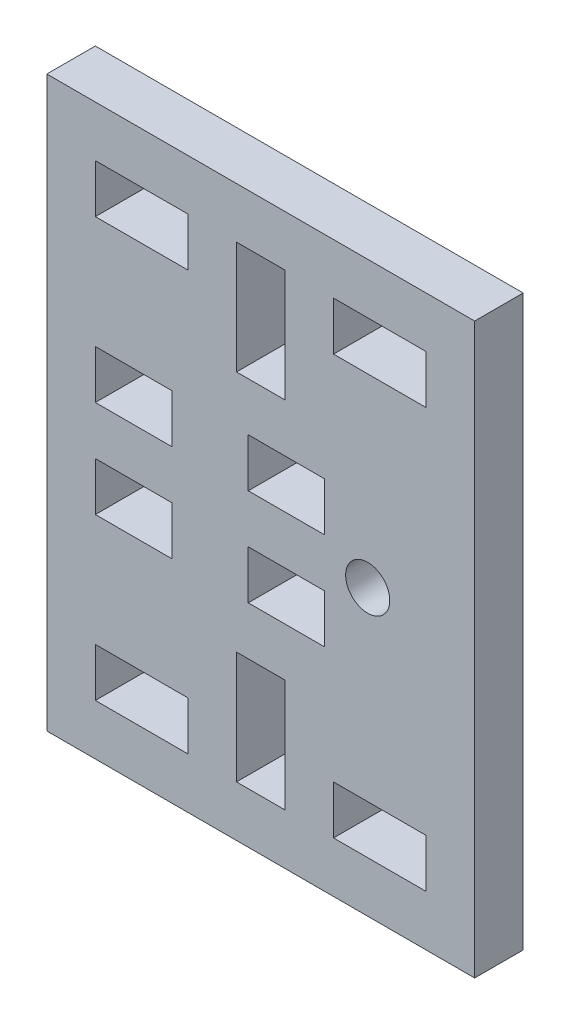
SolidWorks part; units mm, degrees
ref_plane "Front Plane" through (0, 0, 0) normal (0, 0, 1) x (1, 0, 0)
ref_plane "Top Plane" through (0, 0, 0) normal (0, 1, 0) x (1, 0, 0)
ref_plane "Right Plane" through (0, 0, 0) normal (1, 0, 0) x (0, 0, -1)
sketch "Sketch1" plane through (0, 0, 0) normal (0, 0, 1) x (1, 0, 0)
  line L0 (46.3203, -32.6514) -> (3.3203, -32.6514) construction
  line L1 (46.3203, 31.8486) -> (3.3203, 31.8486) construction
  line L2 (3.3203, 31.8486) -> (3.3203, -32.6514) construction
  line L3 (46.3203, 31.8486) -> (46.3203, -32.6514) construction
  line L4 (3.3203, -32.6514) -> (-2.1797, -32.6514) construction
  line L5 (-2.1797, 20.5986) -> (-44.1797, 20.5986) construction
  line L6 (-2.1797, 31.8486) -> (3.3203, 31.8486) construction
  line L7 (3.3203, 20.5986) -> (3.3203, -21.4014) construction
  line L8 (-44.1797, 20.5986) -> (-44.1797, -21.4014) construction
  line L9 (-44.1797, -21.4014) -> (-2.1797, -21.4014) construction
  line L10 (-2.1797, -21.4014) -> (-2.1797, 20.5986) construction
  line L11 (-2.1797, 20.5986) -> (-44.1797, -21.4014) construction
  line L12 (3.3203, 31.8486) -> (3.3203, 26.0986) construction
  line L13 (40.8203, 31.8486) -> (40.8203, -32.6514) construction
  line L14 (3.3203, 26.0986) -> (40.8203, 26.0986) construction
  line L15 (3.3203, -32.6514) -> (3.3203, -26.9014) construction
  line L16 (3.3203, -26.9014) -> (40.8203, -26.9014) construction
  line L17 (3.3203, 26.0986) -> (3.3203, 20.5986) construction
  line L18 (24.8203, -26.9014) -> (19.3203, -26.9014) construction
  line L19 (19.3203, -26.9014) -> (19.3203, -14.1514) construction
  line L20 (19.3203, 26.0986) -> (24.8203, 26.0986) construction
  line L21 (24.8203, 26.0986) -> (24.8203, 13.3486) construction
  line L22 (19.3203, -26.9014) -> (13.8203, -26.9014) construction
  line L23 (13.8203, -26.9014) -> (13.8203, -21.4014) construction
  line L24 (24.8203, 26.0986) -> (30.3203, 26.0986) construction
  line L25 (30.3203, 26.0986) -> (30.3203, 20.5986) construction
  line L26 (3.3203, 20.5986) -> (13.8203, 20.5986) construction
  line L27 (30.3203, 20.5986) -> (40.8203, 20.5986) construction
  line L28 (3.3203, -26.9014) -> (3.3203, -21.4014) construction
  line L29 (3.3203, -3.1514) -> (3.3203, -8.6514) construction
  line L30 (29.3203, -3.1514) -> (3.3203, -3.1514) construction
  line L31 (29.3203, 2.3486) -> (3.3203, 2.3486) construction
  line L32 (3.3203, 2.3486) -> (3.3203, 7.8486) construction
  line L33 (3.3203, 7.8486) -> (29.3203, 7.8486) construction
  line L34 (29.3203, 7.8486) -> (29.3203, 2.3486) construction
  line L35 (3.3203, -8.6514) -> (29.3203, -8.6514) construction
  line L36 (29.3203, -8.6514) -> (29.3203, -3.1514) construction
  line L37 (3.3203, -26.9014) -> (3.3203, -21.4014) construction
  line L38 (3.3203, -26.9014) -> (3.3203, -21.4014) construction
  line L39 (3.3203, -21.4014) -> (13.8203, -21.4014) construction
  line L40 (-44.1797, 20.5986) -> (-2.1797, -21.4014) construction
  line L41 (24.8203, 13.3486) -> (19.3203, 13.3486) construction
  line L42 (24.8203, -26.9014) -> (24.8203, -14.1514) construction
  line L43 (24.8203, -14.1514) -> (19.3203, -14.1514) construction
  line L44 (30.3203, -21.4014) -> (40.8203, -21.4014) construction
  line L45 (30.3203, -21.4014) -> (40.8203, -21.4014)
  line L46 (20.6537, 7.8486) -> (11.987, 7.8486) construction
  line L47 (11.987, 7.8486) -> (11.987, 2.3486) construction
  line L48 (13.8203, 20.5986) -> (13.8203, 26.0986) construction
  line L49 (29.3203, -3.1514) -> (20.6537, -3.1514) construction
  line L50 (20.6537, -3.1514) -> (20.6537, -8.6514) construction
  line L51 (20.6537, -8.6514) -> (11.987, -8.6514) construction
  line L52 (19.3203, 13.3486) -> (19.3203, 26.0986) construction
  line L53 (20.6537, 2.3486) -> (20.6537, 7.8486) construction
  line L54 (11.987, -8.6514) -> (11.987, -3.1514) construction
  line L55 (30.3203, -21.4014) -> (30.3203, -26.9014) construction
  line L56 (-2.1797, 31.8486) -> (46.3203, 31.8486)
  line L57 (46.3203, 31.8486) -> (46.3203, -32.6514)
  line L58 (46.3203, -32.6514) -> (-2.1797, -32.6514)
  line L59 (3.3203, 26.0986) -> (13.8203, 26.0986)
  line L60 (13.8203, 26.0986) -> (13.8203, 20.5986)
  line L61 (13.8203, 20.5986) -> (3.3203, 20.5986)
  line L62 (3.3203, 20.5986) -> (3.3203, 26.0986)
  line L63 (19.3203, 26.0986) -> (19.3203, 13.3486)
  line L64 (19.3203, 13.3486) -> (24.8203, 13.3486)
  line L65 (24.8203, 13.3486) -> (24.8203, 26.0986)
  line L66 (24.8203, 26.0986) -> (19.3203, 26.0986)
  line L67 (30.3203, 26.0986) -> (40.8203, 26.0986)
  line L68 (40.8203, 26.0986) -> (40.8203, 20.5986)
  line L69 (40.8203, 20.5986) -> (30.3203, 20.5986)
  line L70 (30.3203, 20.5986) -> (30.3203, 26.0986)
  line L71 (3.3203, 7.8486) -> (11.987, 7.8486)
  line L72 (11.987, 7.8486) -> (11.987, 2.3486)
  line L73 (11.987, 2.3486) -> (3.3203, 2.3486)
  line L74 (3.3203, 2.3486) -> (3.3203, 7.8486)
  line L75 (20.6537, 7.8486) -> (29.3203, 7.8486)
  line L76 (29.3203, 7.8486) -> (29.3203, 2.3486)
  line L77 (29.3203, 2.3486) -> (20.6537, 2.3486)
  line L78 (20.6537, 2.3486) -> (20.6537, 7.8486)
  line L79 (3.3203, -3.1514) -> (11.987, -3.1514)
  line L80 (11.987, -3.1514) -> (11.987, -8.6514)
  line L81 (11.987, -8.6514) -> (3.3203, -8.6514)
  line L82 (3.3203, -8.6514) -> (3.3203, -3.1514)
  line L83 (20.6537, -3.1514) -> (29.3203, -3.1514)
  line L84 (29.3203, -3.1514) -> (29.3203, -8.6514)
  line L85 (29.3203, -8.6514) -> (20.6537, -8.6514)
  line L86 (20.6537, -8.6514) -> (20.6537, -3.1514)
  line L87 (3.3203, -21.4014) -> (13.8203, -21.4014)
  line L88 (13.8203, -21.4014) -> (13.8203, -26.9014)
  line L89 (13.8203, -26.9014) -> (3.3203, -26.9014)
  line L90 (3.3203, -26.9014) -> (3.3203, -21.4014)
  line L91 (19.3203, -26.9014) -> (19.3203, -14.1514)
  line L92 (19.3203, -14.1514) -> (24.8203, -14.1514)
  line L93 (24.8203, -14.1514) -> (24.8203, -26.9014)
  line L94 (24.8203, -26.9014) -> (19.3203, -26.9014)
  line L95 (30.3203, -26.9014) -> (30.3203, -21.4014)
  line L96 (3.3203, 31.8486) -> (-2.1797, 31.8486) construction
  line L97 (-2.1797, 31.8486) -> (-2.1797, 20.5986) construction
  line L98 (-38.6797, 15.0986) -> (-7.6797, -15.9014) construction
  line L99 (-2.1797, -21.4014) -> (-2.1797, -32.6514) construction
  line L100 (40.8203, -21.4014) -> (40.8203, -26.9014)
  line L101 (40.8203, -26.9014) -> (30.3203, -26.9014)
  line L102 (-2.1797, 31.8486) -> (-2.1797, 20.5986)
  line L106 (-2.1797, -21.4014) -> (-2.1797, -32.6514)
  line L108 (-2.1797, 20.5986) -> (-2.1797, -21.4014)
  line L109 (22.0703, -0.4014) -> (46.3203, -0.4014) construction
  circle A0 centre (34.1953, -0.4014) radius 2.5
  point P9 (3.3203, -0.4014)
  point P13 (46.3203, 31.8486)
  point P23 (22.0703, -26.9014)
  point P39 (29.3203, 2.3486)
  point P43 (29.3203, -3.1514)
  point P52 (16.3203, 7.8486)
  point P55 (24.8203, -20.5264)
  point P56 (24.8203, 19.7236)
  point P61 (-23.1797, -0.4014)
  dimension "D1" = 64.5
  dimension "D2" = 12.75
  dimension "D3" = 26
  dimension "D4" = 40.25
  dimension "D5" = 10.5
  dimension "D6" = 53
  dimension "D7" = 37.5
  dimension "D8" = 8.6667
  dimension "D9" = 10.5
  dimension "D10" = 24.25
extrude "Boss-Extrude1" add sketch "Sketch1" along normal blind 5.5
